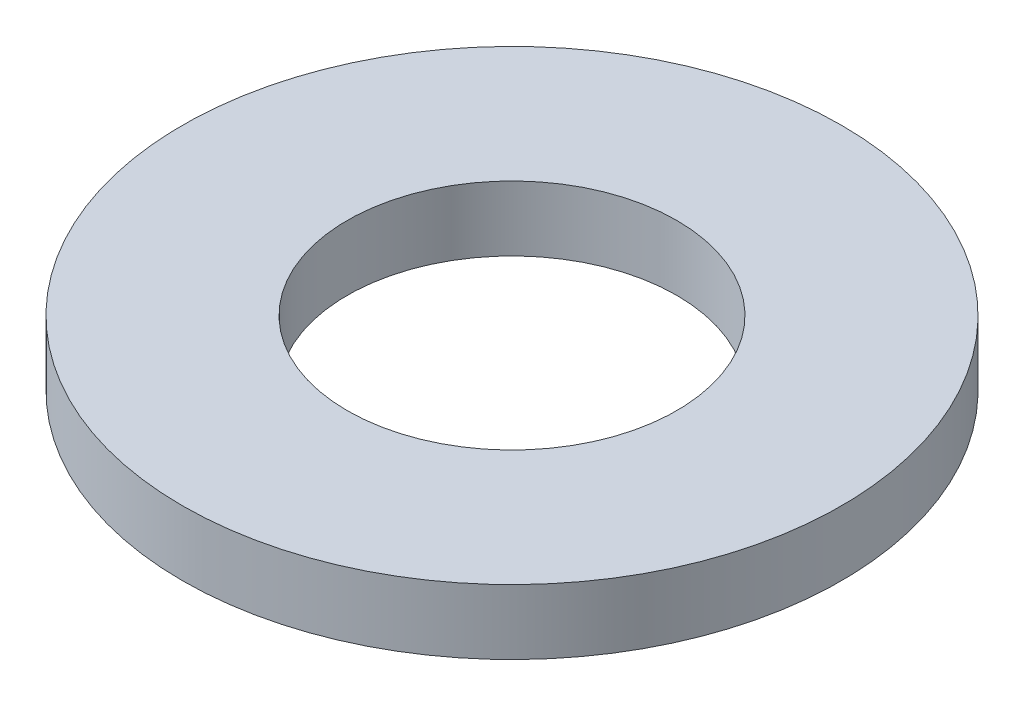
SolidWorks part; units mm, degrees
ref_plane "Front Plane" through (0, 0, 0) normal (0, 0, 1) x (1, 0, 0)
ref_plane "Top Plane" through (0, 0, 0) normal (0, 1, 0) x (1, 0, 0)
ref_plane "Right Plane" through (0, 0, 0) normal (1, 0, 0) x (0, 0, -1)
sketch "Sketch1" plane through (0, 0, 0) normal (0, 1, 0) x (1, 0, 0)
  circle A0 centre (0, 0) radius 10.3124
  dimension "OD" = 20.6248
extrude "Boss-Extrude1" add sketch "Sketch1" along normal blind 2.032
sketch "Sketch5" plane through (0, 2.032, 0) normal (0, 1, 0) x (-1, 0, 0)
  circle A0 centre (0, 0) radius 5.1562
  dimension "ID" = 10.3124
extrude "Cut-Extrude1" cut sketch "Sketch5" against normal through all
